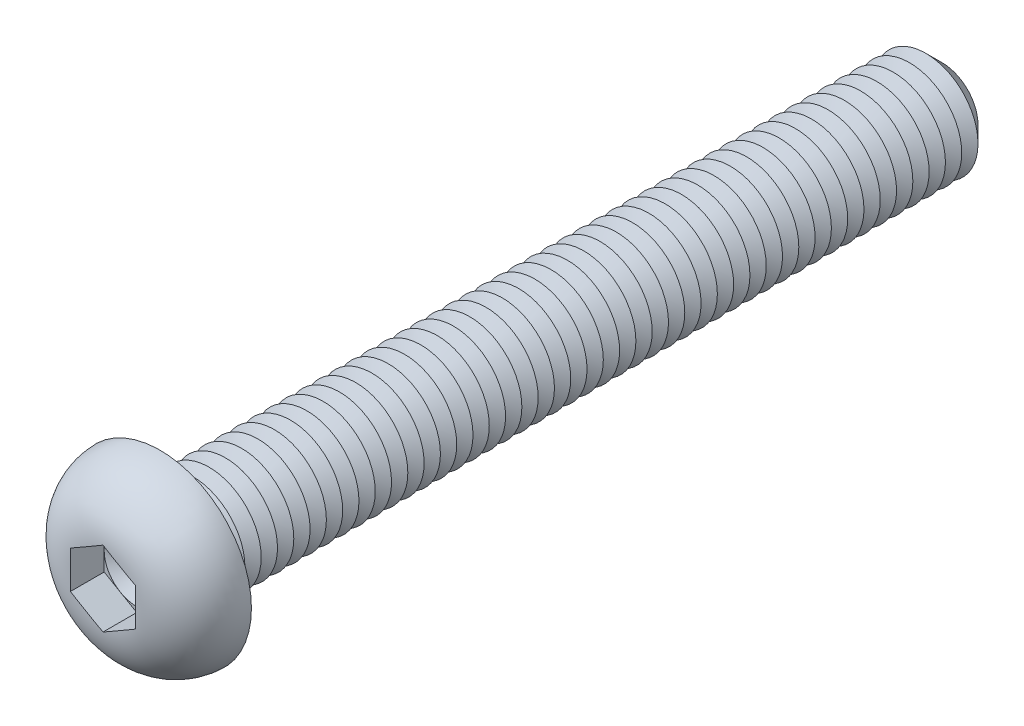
SolidWorks part; units mm, degrees
ref_plane "Front Plane" through (0, 0, 0) normal (0, 0, 1) x (1, 0, 0)
ref_plane "Top Plane" through (0, 0, 0) normal (0, 1, 0) x (1, 0, 0)
ref_plane "Right Plane" through (0, 0, 0) normal (1, 0, 0) x (0, 0, -1)
sketch "Sketch1" plane through (0, 0, 0) normal (1, 0, 0) x (0, 0, -1)
  line L0 (-47.9342, 0) -> (60.3146, 0) construction
sketch "Sketch2" plane through (0, 0, 0) normal (1, 0, 0) x (0, 0, -1)
  line L0 (0, 0) -> (-4.4, 0)
  line L1 (-47.9342, 0) -> (60.3146, 0) construction
  line L2 (-4.4, 0) -> (-4.4, 2.5011)
  line L3 (0, 7) -> (0, 0)
  arc A0 (-4.4, 2.5011) -> (0, 7) centre (0.1, 2.5011) cw
  dimension "D1" = 4.5
  dimension "D2" = 4.4
  dimension "D3" = 7
revolve "Revolve1" add sketch "Sketch2" angle 360 about L0
sketch "Sketch3" plane through (0, 0, 4.4) normal (0, 0, 1) x (1, 0, 0)
  line L1 (0, 2.8868) -> (-2.5, 1.4434)
  line L2 (-2.5, 1.4434) -> (-2.5, -1.4434)
  line L3 (-2.5, -1.4434) -> (0, -2.8868)
  line L4 (0, -2.8868) -> (2.5, -1.4434)
  line L5 (2.5, -1.4434) -> (2.5, 1.4434)
  line L6 (2.5, 1.4434) -> (0, 2.8868)
  circle A0 centre (0, 0) radius 2.5 construction
  dimension "D1" = 5
extrude "Cut-Extrude1" cut sketch "Sketch3" against normal blind 2.6
sketch "Sketch4" plane through (0, 0, 0) normal (0, 0, -1) x (-1, 0, 0)
  circle A0 centre (0, 0) radius 4
  dimension "D1" = 8
extrude "Boss-Extrude1" add sketch "Sketch4" along normal blind 60
chamfer "Chamfer1" distance 1.25 angle 45 1 edges at (-4, 0, -60)
sketch "Sketch5" plane through (0, 0, 0) normal (1, 0, 0) x (0, 0, -1)
  line L0 (1.25, 4) -> (2.5, 4)
  line L1 (58.75, 4) -> (0, 4) construction
  line L2 (2.5, 4) -> (1.875, 2.9175)
  line L3 (1.875, 2.9175) -> (1.25, 4)
  line L4 (0, -7) -> (0, 7) construction
  line L5 (58.75, 4) -> (0, 4) construction
  dimension "D1" = 1.25
  dimension "D2" = 1.25
revolve "Cut-Revolve1" cut sketch "Sketch5" angle 360 about L0
pattern_linear "LPattern1" count 46 spacing 1.25 along (0, 0, -1) of "Cut-Revolve1"
fillet "Fillet2" radius 0.5 1 edges at (4, 0, 0)
sketch "Sketch6" plane through (0, 0, 1.8) normal (0, 0, 1) x (1, 0, 0)
  line L0 (0, -2.8868) -> (2.5, -1.4434) construction
  circle A0 centre (0, 0) radius 2.5
extrude "Cut-Extrude2" cut sketch "Sketch6" against normal through all draft 60
